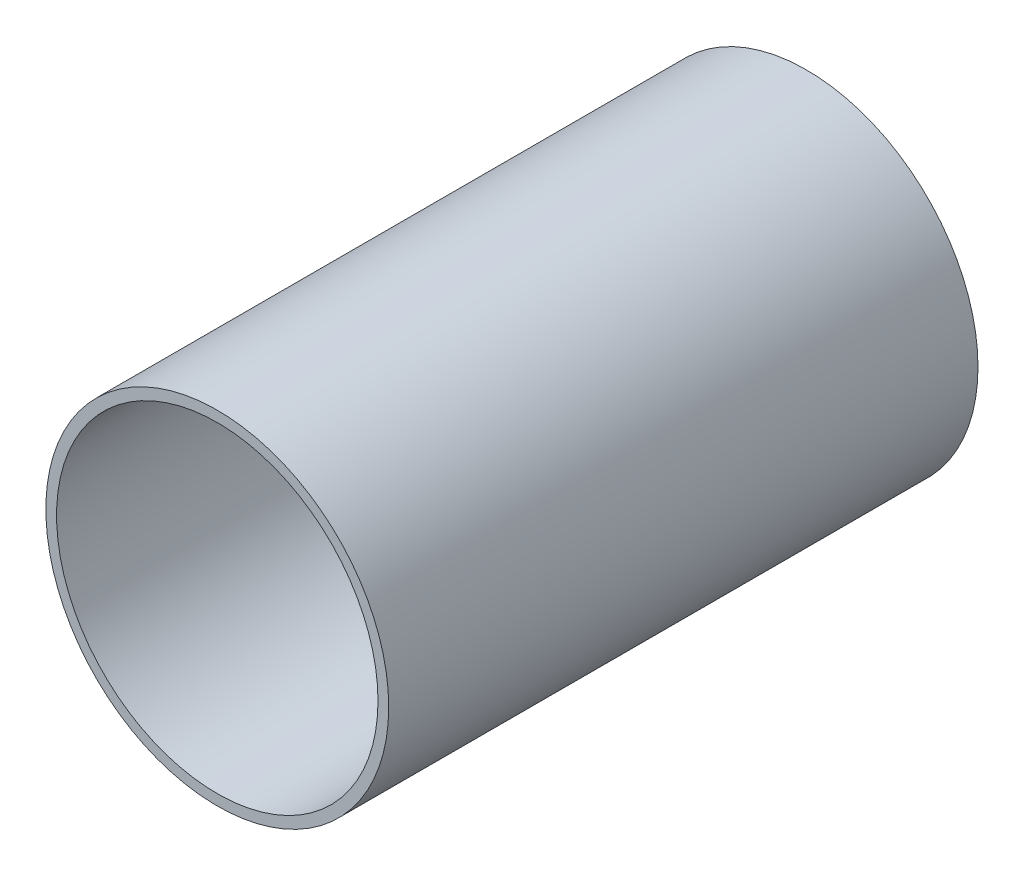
SolidWorks part; units mm, degrees
ref_plane "Front Plane" through (0, 0, 0) normal (0, 0, 1) x (1, 0, 0)
ref_plane "Top Plane" through (0, 0, 0) normal (0, 1, 0) x (1, 0, 0)
ref_plane "Right Plane" through (0, 0, 0) normal (1, 0, 0) x (0, 0, -1)
sketch "Sketch1" plane through (0, 0, 0) normal (0, 0, 1) x (1, 0, 0)
  circle A0 centre (0, 0) radius 6.4
  circle A1 centre (0, 0) radius 6
extrude "Boss-Extrude1" add sketch "Sketch1" along normal blind 22 contours A1 | A0
